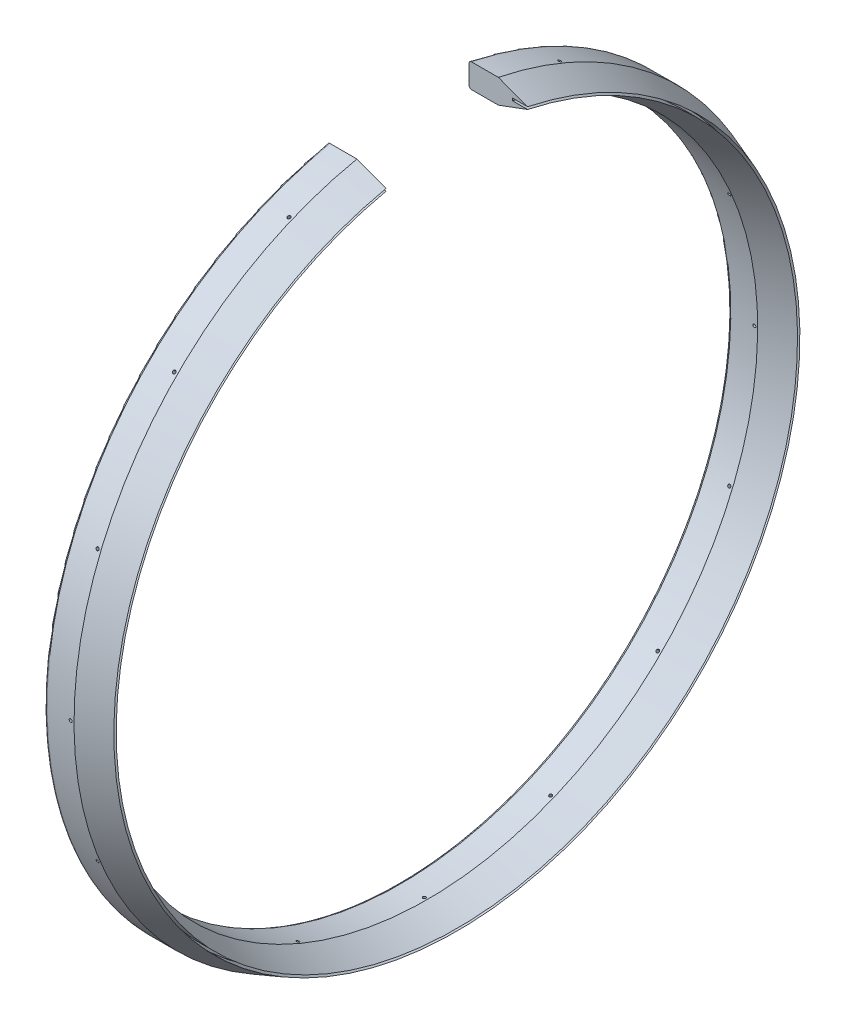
SolidWorks part; units mm, degrees
ref_plane "Front Plane" through (0, 0, 0) normal (0, 0, 1) x (1, 0, 0)
ref_plane "Top Plane" through (0, 0, 0) normal (0, 1, 0) x (1, 0, 0)
ref_plane "Right Plane" through (0, 0, 0) normal (1, 0, 0) x (0, 0, -1)
sketch "Sketch1" plane through (0, 0, 0) normal (0, 0, 1) x (1, 0, 0)
  line L0 (-102.6213, 0) -> (114.7318, 0) construction
  line L1 (0, 171.1472) -> (0, -96.0348) construction
  line L2 (-116.9575, 140) -> (98.0585, 140) construction
  line L3 (-12.4, 140) -> (-12.4, 150)
  line L4 (0, 150) -> (12.4, 145.5)
  line L5 (12.4, 145.5) -> (6, 145.5)
  line L6 (6, 145.5) -> (6, 144.5)
  line L7 (6, 144.5) -> (12.4, 144.5)
  line L8 (12.4, 144.5) -> (0, 140)
  line L9 (0, 140) -> (-12.4, 140)
  line L10 (-12.4, 150) -> (0, 150)
  line L11 (-20.0531, 145) -> (33.8864, 145) construction
  point P23 (-12.4, 140)
  point P26 (-12.4, 150)
  dimension "D11" = 145
  dimension "D2" = 10
  dimension "D3" = 12.4
  dimension "D4" = 12.4
  dimension "D5" = 12.4
  dimension "D6" = 6.4
  dimension "D7" = 12.4
  dimension "D8" = 1
  dimension "D9" = 5
  dimension "D10" = 12.4
revolve "Revolve1" add sketch "Sketch1" angle 360 about L0
sketch "Sketch2" plane through (-12.4, 0, 0) normal (-1, 0, 0) x (0, 0, 1)
  line L0 (0, 154.196) -> (0, -158.1567) construction
  line L1 (-155.5187, 0) -> (160.1218, 0) construction
  line L2 (-177.229, 0) -> (177.229, 0) construction
  circle A0 centre (0, 0) radius 145 construction
  circle A1 centre (0, 145) radius 1.1303
  dimension "D1" = 290
  dimension "D2" = 2.2606
  dimension "D3" = 90
extrude "Cut-Extrude1" [suppressed] cut sketch "Sketch2" against normal blind 6.35
pattern_circular "CirPattern1" [suppressed] count 24 over 360
sketch "Sketch3" plane through (0, 0, 0) normal (0, 1, 0) x (1, 0, 0)
  line L0 (-51.1842, 0) -> (47.033, 0) construction
  line L2 (-25, 30) -> (25, 30)
  line L3 (-25, 30) -> (-25, -30)
  line L4 (-25, -30) -> (25, -30)
  line L5 (25, 30) -> (25, -30)
  line L6 (0, -150) -> (0, 150) construction
  dimension "D1" = 60
  dimension "D2" = 50
  dimension "D3" = 25
extrude "Cut-Extrude2" cut sketch "Sketch3" along normal blind 177.8
hole_wizard "M5x0.8 Tapped Hole1" positions "3DSketch1" profile "Sketch4" tap size "M5x0.8" standard "Ansi Metric"
sketch3d "3DSketch1"
  line L1 (-12.4, 0, -177.229) -> (-12.4, 0, 177.229) construction
  circle A0 centre (-12.4, 0, 0) radius 145 construction
  point P10 (-12.4, 0, -145)
  point P16 (-157.4, 0, 0)
sketch "Sketch4" plane through (-12.4, 0, -145) normal (0, 1, 0) x (0, 0, 1)
  line L0 (0, 0) -> (0, 11.6618)
  line L1 (0, 11.6618) -> (2.1, 10.4)
  line L2 (2.1, 10.4) -> (2.1, 0)
  line L5 (2.1, 0) -> (0, 0)
  line L10 (0, 11.6618) -> (-2.1, 10.4) construction
  line L11 (0, -6.35) -> (0, 107.95) construction
  dimension "Tap Drill Dia." = 4.2
  dimension "Tap Drill Depth" = 10.4
  dimension "Drill Angle" = 118
pattern_circular "CirPattern2" count 16 over 360 about axis through (0, 0, 0) along (1, 0, 0) of "M5x0.8 Tapped Hole1"
sketch "Sketch5" plane through (0, 0, 0) normal (0, 1, 0) x (1, 0, 0)
  line L0 (-19.1658, 0) -> (18.0111, 0) construction
  line L1 (-1.4, 30.6126) -> (-1.4, -13.6803) construction
  line L2 (-12.4, 155.5187) -> (-12.4, -160.1218) construction
  circle A0 centre (-1.4, 0) radius 0.635
  dimension "D2" = 1.27
  dimension "D1" = 11
extrude "Cut-Extrude3" cut sketch "Sketch5" against normal blind 175
pattern_circular "CirPattern3" count 16 over 360 about axis through (-12.4, 0, 0) along (-1, 0, 0) of "Cut-Extrude3"
fillet "Fillet1" radius 1 2 edges at (-12.4, -140, 0) (-12.4, -150, 0)
